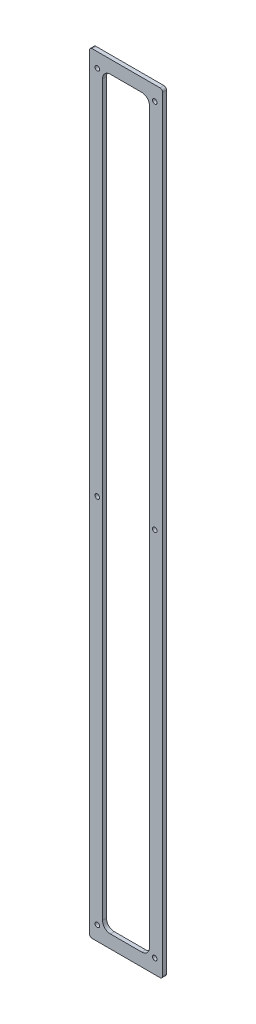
SolidWorks part; units mm, degrees
ref_plane "Front Plane" through (0, 0, 0) normal (0, 0, 1) x (1, 0, 0)
ref_plane "Top Plane" through (0, 0, 0) normal (0, 1, 0) x (1, 0, 0)
ref_plane "Right Plane" through (0, 0, 0) normal (1, 0, 0) x (0, 0, -1)
sketch "Sketch1" plane through (0, 0, 0) normal (0, 0, 1) x (1, 0, 0)
  line L0 (176.0788, 176.0709) -> (-176.0668, 176.0709) construction
  line L1 (-44.444, 468.376) -> (44.456, 468.376)
  line L2 (-44.444, 468.376) -> (-44.444, -468.376)
  line L3 (-44.444, -468.376) -> (44.456, -468.376)
  line L4 (44.456, 468.376) -> (44.456, -468.376)
  point P10 (0.006, 468.376)
  point P13 (0.006, 176.0709)
  point P14 (-44.444, 0)
  dimension "D1" = 936.752
  dimension "D2" = 88.9
extrude "Boss-Extrude1" add sketch "Sketch1" along normal blind 4.7752
sketch "Sketch2" plane through (0, 0, 4.7752) normal (0, 0, 1) x (1, 0, 0)
  line L1 (-28.575, 452.501) -> (28.575, 452.501)
  line L2 (-28.575, 452.501) -> (-28.575, -452.501)
  line L3 (-28.575, -452.501) -> (28.575, -452.501)
  line L4 (28.575, 452.501) -> (28.575, -452.501)
  point P4 (-28.575, 0)
  point P5 (0, 452.501)
  dimension "D1" = 905.002
  dimension "D2" = 57.15
extrude "Cut-Extrude1" cut sketch "Sketch2" against normal through all
hole_wizard "7/32 (0.21875) Diameter Hole1" positions "Sketch3" profile "Sketch4" hole size "7/32" standard "ANSI Inch"
sketch "Sketch3" plane through (0, 0, 4.7752) normal (0, 0, 1) x (1, 0, 0)
  line L0 (-44.444, -468.376) -> (44.456, -468.376) construction
  line L1 (-34.931, -450.85) -> (34.931, -450.85) construction
  line L2 (-34.931, 0) -> (34.931, 0) construction
  line L3 (-34.931, 450.85) -> (34.931, 450.85) construction
  point P6 (34.931, -450.85)
  point P9 (-34.931, -450.85)
  point P28 (0, -450.85)
  point P33 (34.931, 0)
  point P34 (-34.931, 0)
  point P38 (34.931, 450.85)
  point P39 (-34.931, 450.85)
  dimension "D1" = 17.526
  dimension "D2" = 69.8619
  dimension "D3" = 450.85
  dimension "D4" = 450.85
sketch "Sketch4" plane through (34.931, -450.85, 4.7752) normal (1, 0, 0) x (0, -1, 0)
  line L0 (0, 0) -> (0, 4.7752)
  line L1 (0, 4.7752) -> (2.7781, 4.7752)
  line L2 (2.7781, 4.7752) -> (2.7781, 0)
  line L5 (2.7781, 0) -> (0, 0)
  line L11 (0, -6.35) -> (0, 107.95) construction
  dimension "Thru Hole Dia." = 5.5562
  dimension "Thru Hole Depth" = 4.7752
fillet "Fillet1" radius 3.175 4 edges at (44.456, -468.376, 2.3876) (-44.444, -468.376, 2.3876) (-44.444, 468.376, 2.3876) (44.456, 468.376, 2.3876)
fillet "Fillet2" radius 9.525 4 edges at (28.575, -452.501, 2.3876) (-28.575, -452.501, 2.3876) (28.575, 452.501, 2.3876) (-28.575, 452.501, 2.3876)
